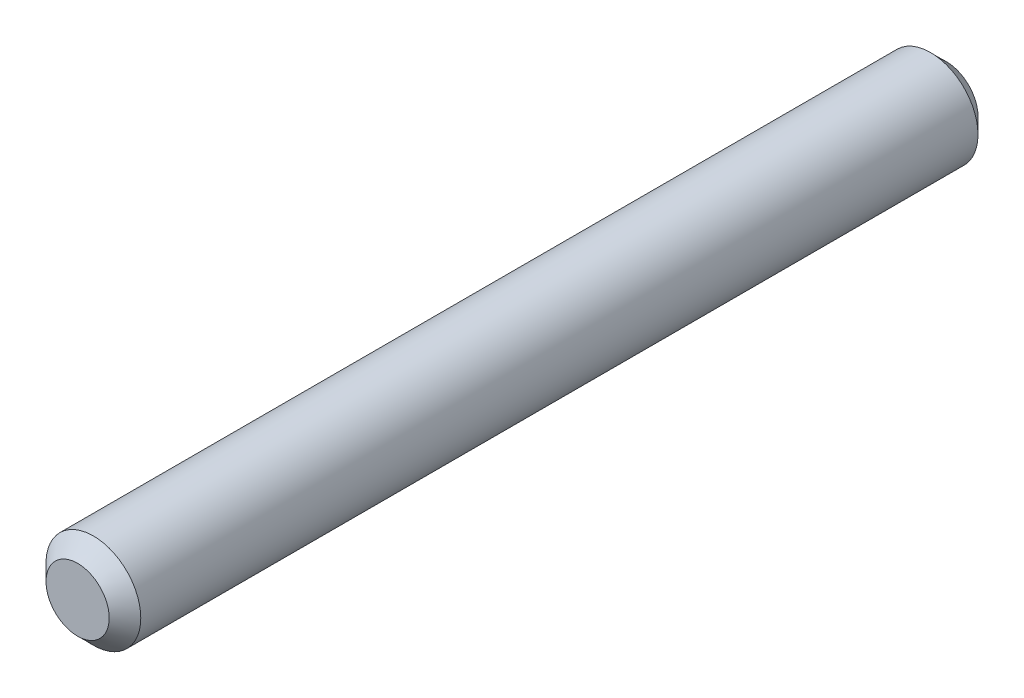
SolidWorks part; units mm, degrees
ref_plane "Plan1" through (0, 0, 0) normal (0, 0, 1) x (1, 0, 0)
ref_plane "Plan2" through (0, 0, 0) normal (0, 1, 0) x (1, 0, 0)
ref_plane "Plan3" through (0, 0, 0) normal (1, 0, 0) x (0, 0, -1)
sketch "Esquisse1" plane through (0, 0, 0) normal (0, 0, 1) x (1, 0, 0)
  circle A0 centre (0, 0) radius 3
  dimension "D1" = 6
extrude "Base-Extrusion" add sketch "Esquisse1" against normal blind 55
chamfer "Chanfrein1" distance 1 angle 45
